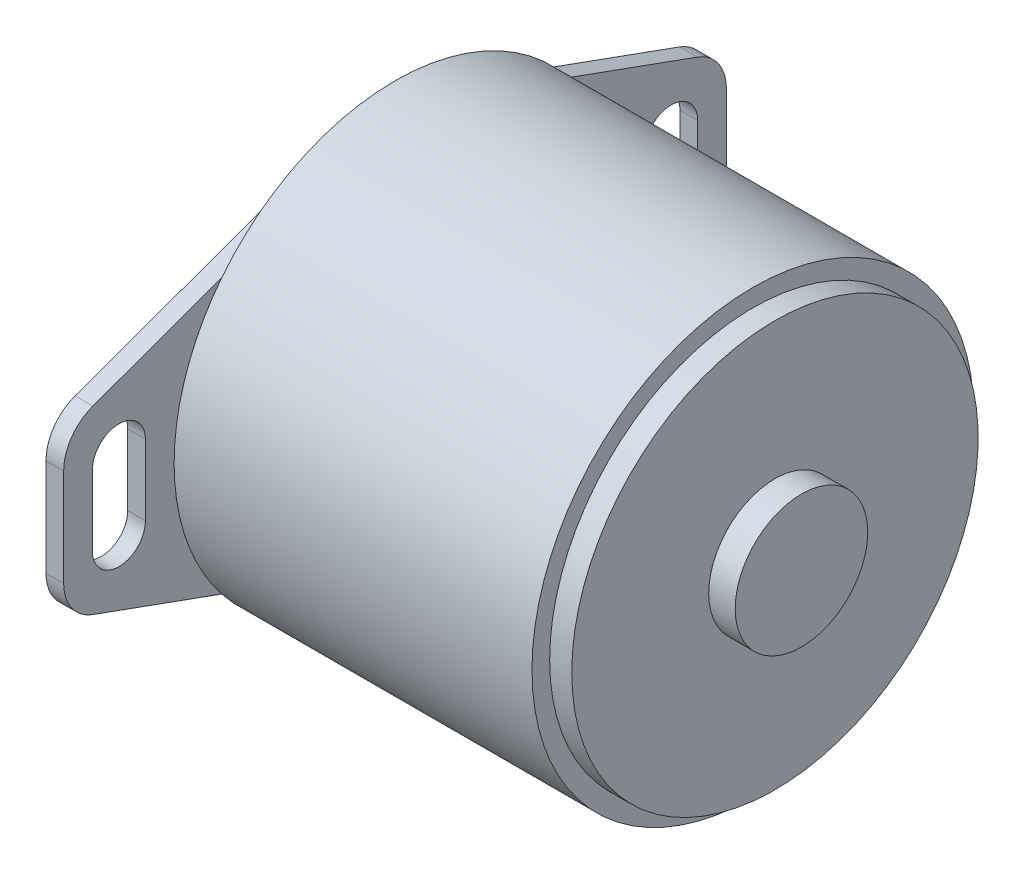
SolidWorks part; units mm, degrees
ref_plane "Front Plane" through (0, 0, 0) normal (0, 0, 1) x (1, 0, 0)
ref_plane "Top Plane" through (0, 0, 0) normal (0, 1, 0) x (1, 0, 0)
ref_plane "Right Plane" through (0, 0, 0) normal (1, 0, 0) x (0, 0, -1)
sketch "Sketch1" plane through (0, 0, 0) normal (0, 0, 1) x (1, 0, 0)
  line L0 (-32.4415, 0) -> (34.9969, 0) construction
  line L1 (0, 0) -> (0, 0.75)
  line L2 (0, 0.75) -> (4.2, 0.75)
  line L3 (4.2, 0.75) -> (4.2, 3)
  line L4 (4.2, 3) -> (6.2, 3)
  line L5 (6.2, 3) -> (6.2, 10)
  line L6 (6.2, 10) -> (22.4, 10)
  line L7 (22.4, 10) -> (22.4, 9.2)
  line L8 (22.4, 9.2) -> (23.4, 9.2)
  line L9 (23.4, 9.2) -> (23.4, 3)
  line L10 (23.4, 3) -> (24.6, 3)
  line L11 (24.6, 3) -> (24.6, 0)
  line L12 (0, 0) -> (24.6, 0)
  dimension "D1" = 20
  dimension "D2" = 6
  dimension "D3" = 1.5
  dimension "D4" = 2
  dimension "D5" = 6.2
  dimension "D6" = 17.2
  dimension "D7" = 1.2
  dimension "D8" = 1
  dimension "D9" = 0.8
revolve "Revolve1" add sketch "Sketch1" angle 360 about L0
sketch "Sketch2" plane through (6.2, 0, 0) normal (-1, 0, 0) x (0, 0, 1)
  line L0 (-2.8928, 7.9926) -> (-13.6807, 4.0881)
  line L1 (-15, 2.2075) -> (-15, -2.2075)
  line L2 (-13.6807, -4.0881) -> (-2.8928, -7.9926)
  line L3 (-12.5, 0) -> (10, 0) construction
  line L4 (0, 10.8232) -> (0, -10.6904) construction
  line L5 (-12.5, 1.6) -> (-12.5, -1.6) construction
  line L6 (-11.3, 1.6) -> (-11.3, -1.6)
  line L7 (-13.7, 1.6) -> (-13.7, -1.6)
  line L8 (13.6807, -4.0881) -> (2.8928, -7.9926)
  line L9 (15, 2.2075) -> (15, -2.2075)
  line L10 (2.8928, 7.9926) -> (13.6807, 4.0881)
  line L11 (12.5, 1.6) -> (12.5, -1.6) construction
  line L12 (11.3, 1.6) -> (11.3, -1.6)
  line L13 (13.7, 1.6) -> (13.7, -1.6)
  arc A0 (-2.8928, -7.9926) -> (2.8928, -7.9926) centre (0, 0) ccw
  circle A1 centre (0, 0) radius 10 construction
  arc A2 (-11.3, 1.6) -> (-13.7, 1.6) centre (-12.5, 1.6) ccw
  arc A3 (-13.7, -1.6) -> (-11.3, -1.6) centre (-12.5, -1.6) ccw
  arc A4 (2.8928, 7.9926) -> (-2.8928, 7.9926) centre (0, 0) ccw
  arc A5 (11.3, 1.6) -> (13.7, 1.6) centre (12.5, 1.6) cw
  arc A6 (13.7, -1.6) -> (11.3, -1.6) centre (12.5, -1.6) cw
  arc A7 (13.6807, 4.0881) -> (15, 2.2075) centre (13, 2.2075) cw
  arc A8 (15, -2.2075) -> (13.6807, -4.0881) centre (13, -2.2075) cw
  arc A9 (-13.6807, -4.0881) -> (-15, -2.2075) centre (-13, -2.2075) cw
  arc A10 (-13.6807, 4.0881) -> (-15, 2.2075) centre (-13, 2.2075) ccw
  circle A11 centre (0, 0) radius 4.1288
  point P16 (-12.5, 0)
  point P27 (12.5, 0)
  point P34 (15, 3.6106)
  point P37 (15, -3.6106)
  point P40 (-15, -3.6106)
  point P43 (-15, 3.6106)
  dimension "D2" = 17
  dimension "D3" = 25
  dimension "D5" = 5.6
  dimension "D6" = 2
  dimension "D1" = 30
  dimension "D4" = 2.4
extrude "Boss-Extrude1" add sketch "Sketch2" along normal blind 0.8
